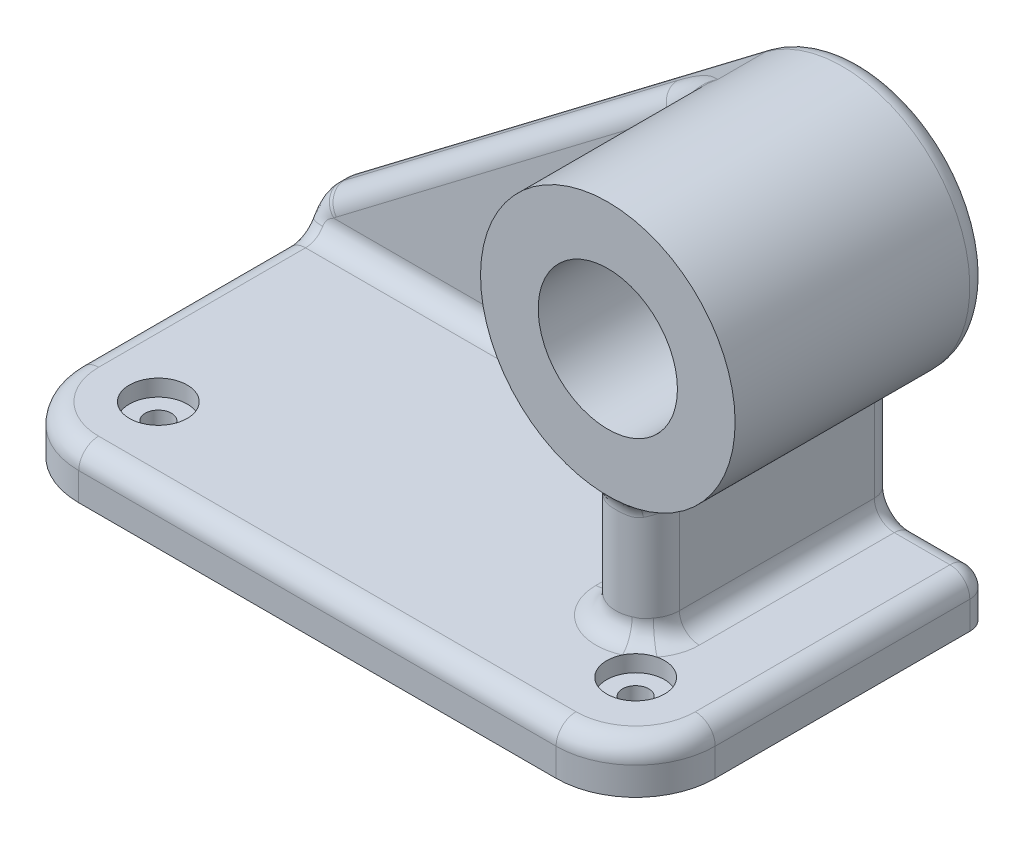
SolidWorks part; units mm, degrees
ref_plane "Front" through (0, 0, 0) normal (0, 0, 1) x (1, 0, 0)
ref_plane "Top" through (0, 0, 0) normal (0, 1, 0) x (1, 0, 0)
ref_plane "Right" through (0, 0, 0) normal (1, 0, 0) x (0, 0, -1)
sketch "Sketch1" plane through (0, 0, 0) normal (0, 1, 0) x (1, 0, 0)
  line L0 (0, 0) -> (160, 0)
  line L1 (0, 0) -> (0, 89)
  line L2 (160, 89) -> (0, 89)
  line L3 (160, 89) -> (160, 0)
  dimension "D3" = 89
  dimension "D4" = 160
extrude "Base_Plate" add sketch "Sketch1" along normal blind 12
fillet "Base_Fillet" radius 20 2 edges at (0, 6, 0) (160, 6, 0)
sketch "Sketch2" plane through (0, 0, -89) normal (0, 0, -1) x (-1, 0, 0)
  line L1 (-20, 0) -> (-140, 0) construction
  line L2 (-160, 12) -> (0, 12) construction
  line L3 (-160, 12) -> (0, 12)
  line L4 (-160, 12) -> (-160, 0) construction
  line L5 (-160, 12) -> (-160, 75)
  line L6 (-4.7413, 21.5557) -> (-108.6435, 100.4819)
  arc A0 (-108.6435, 100.4819) -> (-160, 75) centre (-128, 75) ccw
  arc A1 (0, 12) -> (-4.7413, 21.5557) centre (-12, 12) ccw
  dimension "D1" = 64
  dimension "D4" = 12
  dimension "D2" = 75
extrude "Vertical_Plate" add sketch "Sketch2" against normal blind 12
ref_plane "Circular_Plane" through (0, 0, -100) normal (0, 0, -1) x (-1, 0, 0)
sketch "Sketch3" plane through (0, 0, -89) normal (0, 0, -1) x (-1, 0, 0)
  circle A0 centre (-128, 75) radius 32
  arc A1 (-108.6435, 100.4819) -> (-160, 75) centre (-128, 75) ccw construction
extrude "Circular_Boss" add sketch "Sketch3" against normal blind 64
sketch "Sketch4" plane through (0, 12, 0) normal (0, 1, 0) x (-1, 0, 0)
  line L0 (-96, -25) -> (-160, -25) construction
  line L1 (-96, -77) -> (-160, -77) construction
  line L2 (-120, -77) -> (-120, -35)
  line L3 (-128, -77) -> (-128, -89) construction
  line L5 (-136, -77) -> (-136, -35)
  line L7 (-136, -77) -> (-120, -77)
  arc A0 (-136, -35) -> (-120, -35) centre (-128, -35) cw
  dimension "D1" = 2
  dimension "D2" = 8
extrude "Rib_Under" add sketch "Sketch4" along normal up to next
sketch "Sketch7"
  circle A0 centre (128, 75) radius 17.5
fillet "Rib_Fillet" radius 5 7 edges at (120, 44.0161, -56) (120, 12, -56) (128, 12, -27) (136, 12, -62) (136, 44.0161, -62) (128.8079, 43.0102, -27.0409)
fillet "Circ_Fillet" radius 5 9 edges at (150.5, 12, -89) (136, 28.6795, -89) (137.4645, 13.4645, -89) (136.89, 43.2065, -89) (1.2505, 17.3336, -89) (56.6924, 61.0188, -89) (156.0161, 90.4628, -89) (0, 6, -89)
extrude "Cut-Extrude3" cut sketch "Sketch7" against normal through all
sketch "Sketch8" plane through (0, 0, -77) normal (0, 0, 1) x (1, 0, 0)
  line L3 (136, 44.0161) -> (136, 12)
  line L4 (136, 12) -> (160, 12)
  line L5 (160, 12) -> (160, 75)
  line L6 (136, 44.0161) -> (136, 12)
  line L7 (136, 12) -> (160, 12)
  line L8 (160, 12) -> (160, 75)
  arc A4 (136, 44.0161) -> (160, 75) centre (128, 75) ccw
  arc A7 (136, 44.0161) -> (160, 75) centre (128, 75) ccw
  dimension "D1" = 0
extrude "Cut-Extrude4" cut sketch "Sketch8" against normal through all
hole_wizard "CBORE for M6 Hex Head Cap Screw1" positions "Sketch10" profile "Sketch9" counterbore size "M6" standard "ANSI Metric"
sketch "Sketch10" plane through (0, 12, 0) normal (0, 1, 0) x (-1, 0, 0)
  point P0 (-20, -20)
  point P3 (-140, -20)
sketch "Sketch9" plane through (20, 12, -20) normal (1, 0, 0) x (0, 0, 1)
  line L0 (0, 0) -> (0, 12)
  line L1 (0, 12) -> (3.3, 12)
  line L3 (3.3, 12) -> (3.3, 4.15)
  line L4 (3.3, 4.15) -> (7.275, 4.15)
  line L5 (7.275, 4.15) -> (7.275, 0)
  line L7 (7.275, 0) -> (0, 0)
  line L11 (0, -6.35) -> (0, 107.95) construction
  dimension "Thru Hole Dia." = 6.6
  dimension "Thru Hole Depth" = 12
  dimension "C'Bore Dia." = 14.55
  dimension "C'Bore Depth" = 4.15
fillet "Fillet1" radius 5 5 edges at (96.3372, 70.3665, -77) (119.11, 43.2065, -77) (120, 28.6795, -77) (118.5355, 13.4645, -77)
fillet "Fillet2" radius 5 11 edges at (160, 3.5, -89) (160, 10.5355, -87.5355) (154.1421, 12, -5.8579) (80, 12, 0) (5.8579, 12, -5.8579) (0.0498, 13.0921, -75.1191) (100.7153, 94.4595, -75.5835) (49.297, 55.4011, -77)
